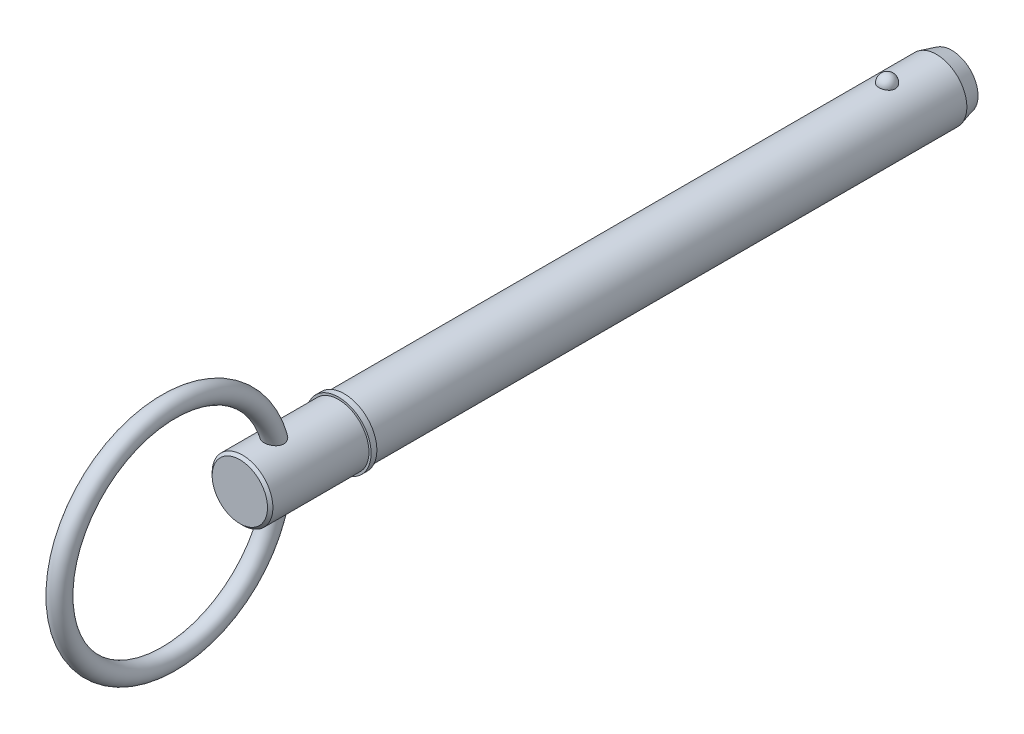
SolidWorks part; units mm, degrees
ref_plane "Front Plane" through (0, 0, 0) normal (0, 0, 1) x (1, 0, 0)
ref_plane "Top Plane" through (0, 0, 0) normal (0, 1, 0) x (1, 0, 0)
ref_plane "Right Plane" through (0, 0, 0) normal (1, 0, 0) x (0, 0, -1)
sketch "Sketch2" plane through (0, 0, 0) normal (0, 0, 1) x (1, 0, 0)
  circle A0 centre (0, 0) radius 7.94
  point P3 (0, 7.94)
  dimension "D1" = 15.88
extrude "Boss-Extrude1" add sketch "Sketch2" along normal blind 139.7
sketch "Sketch3" plane through (0, 0, 0) normal (0, 0, -1) x (-1, 0, 0)
  circle A0 centre (0, 0) radius 7.94
  dimension "D1" = 15.88
extrude "Boss-Extrude2" add sketch "Sketch3" along normal blind 19.05
chamfer "Chamfer1" distance 4 angle 15 1 edges at (-7.94, 0, -19.05)
sketch "Sketch18" plane through (0, 0, 0) normal (1, 0, 0) x (0, 0, -1)
  line L0 (15.05, 7.94) -> (-139.7, 7.94) construction
  line L1 (2.15, 10.09) -> (2.15, 5.79)
  line L2 (-139.7, -7.94) -> (15.05, -7.94) construction
  arc A0 (2.15, 10.09) -> (2.15, 5.79) centre (2.15, 7.94) ccw
  point P4 (0, 7.94)
  dimension "D1" = 18.03
revolve "Revolve1" add sketch "Sketch18" angle 360 about L1
sketch "Sketch19" plane through (0, 0, 0) normal (1, 0, 0) x (0, 0, -1)
  line L0 (-33.7288, 0) -> (-46.4542, 0) construction
sketch "Sketch20" plane through (0, 0, 0) normal (1, 0, 0) x (0, 0, -1)
  line L0 (-139.7, 0) -> (-139.7, 8.5)
  line L1 (-139.7, 7.94) -> (-139.7, -7.94) construction
  line L2 (-139.7, 8.5) -> (-141.2, 8.5)
  line L3 (-141.2, 8.5) -> (-141.2, 0)
  line L4 (-33.7288, 0) -> (-46.4542, 0) construction
  line L5 (-141.2, 0) -> (-139.7, 0)
  dimension "D1" = 8.5
  dimension "D2" = 1.5
revolve "Revolve2" add sketch "Sketch20" angle 360 about L0
sketch "Sketch21" plane through (0, 0, 139.7) normal (0, 0, -1) x (-1, 0, 0)
  circle A0 centre (0, 0) radius 7.94
  dimension "D1" = 15.88
extrude "Boss-Extrude3" add sketch "Sketch21" against normal blind 27.31
chamfer "Chamfer2" distance 0.7 angle 45 1 edges at (-7.94, 0, 167.01)
sketch "Sketch23" plane through (0, 0, 0) normal (1, 0, 0) x (0, 0, -1)
  line L0 (-167.01, 7.24) -> (-167.01, -7.24) construction
  circle A0 centre (-185.585, 0) radius 28.575
  point P2 (-157.01, 0)
  dimension "D1" = 57.15
  dimension "D2" = 10
sketch "Sketch24" plane through (0, 0, 0) normal (0, 1, 0) x (1, 0, 0)
  circle A0 centre (0, -157.01) radius 2.5
  dimension "D1" = 5
sweep "Sweep1" add profiles "Sketch24" path "Sketch23"
